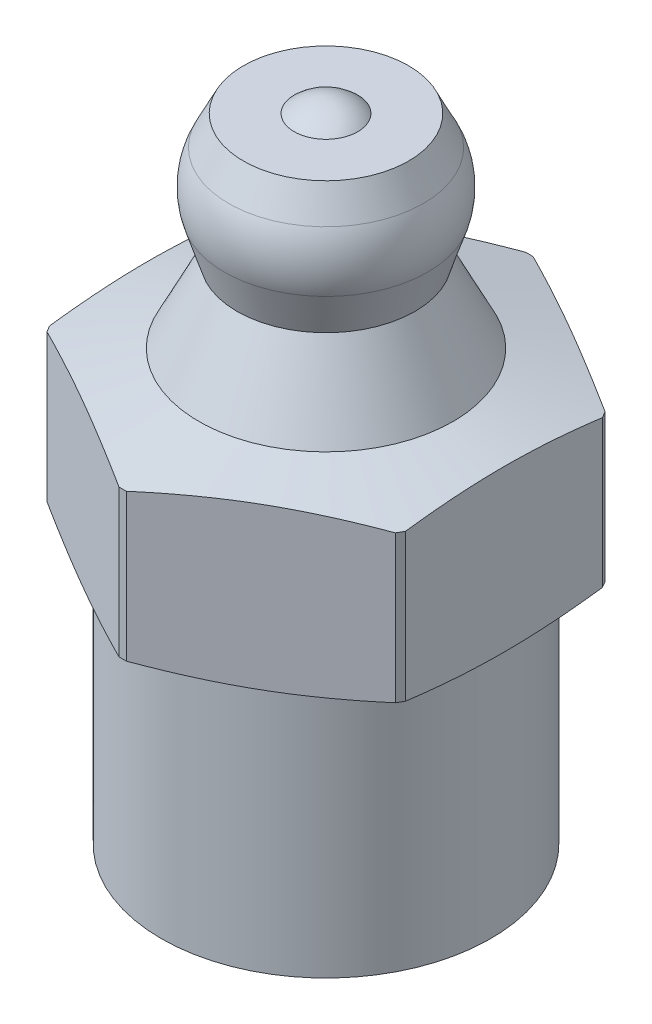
SolidWorks part; units mm, degrees
ref_plane "Face" through (0, 0, 0) normal (0, 0, 1) x (1, 0, 0)
ref_plane "Dessus" through (0, 0, 0) normal (0, 1, 0) x (1, 0, 0)
ref_plane "Droite" through (0, 0, 0) normal (1, 0, 0) x (0, 0, -1)
imported_body "Imported1"
sketch "Sketch1" plane through (0, 0, 0) normal (0, 1, 0) x (1, 0, 0)
  circle A0 centre (0, 0) radius 11.1912
extrude "Cut-Extrude1" cut sketch "Sketch1" along normal blind 12
